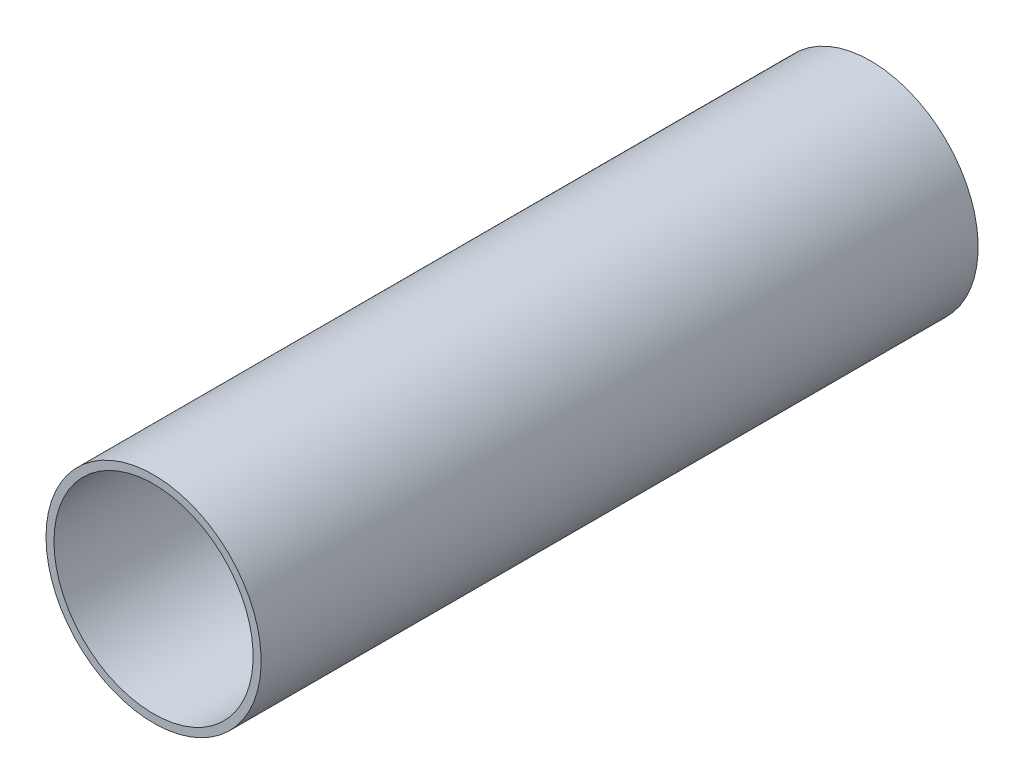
SolidWorks part; units mm, degrees
ref_plane "Plano frontal" through (0, 0, 0) normal (0, 0, 1) x (1, 0, 0)
ref_plane "Plano superior" through (0, 0, 0) normal (0, 1, 0) x (1, 0, 0)
ref_plane "Plano direito" through (0, 0, 0) normal (1, 0, 0) x (0, 0, -1)
sketch "Esboço1" plane through (0, 0, 0) normal (0, 0, 1) x (1, 0, 0)
  circle A0 centre (0, 0) radius 27
  circle A1 centre (0, 0) radius 25
surface "Superfície-Extrusão1" sketch "Esboço1" parameters "D1"=90, "D2"=90
